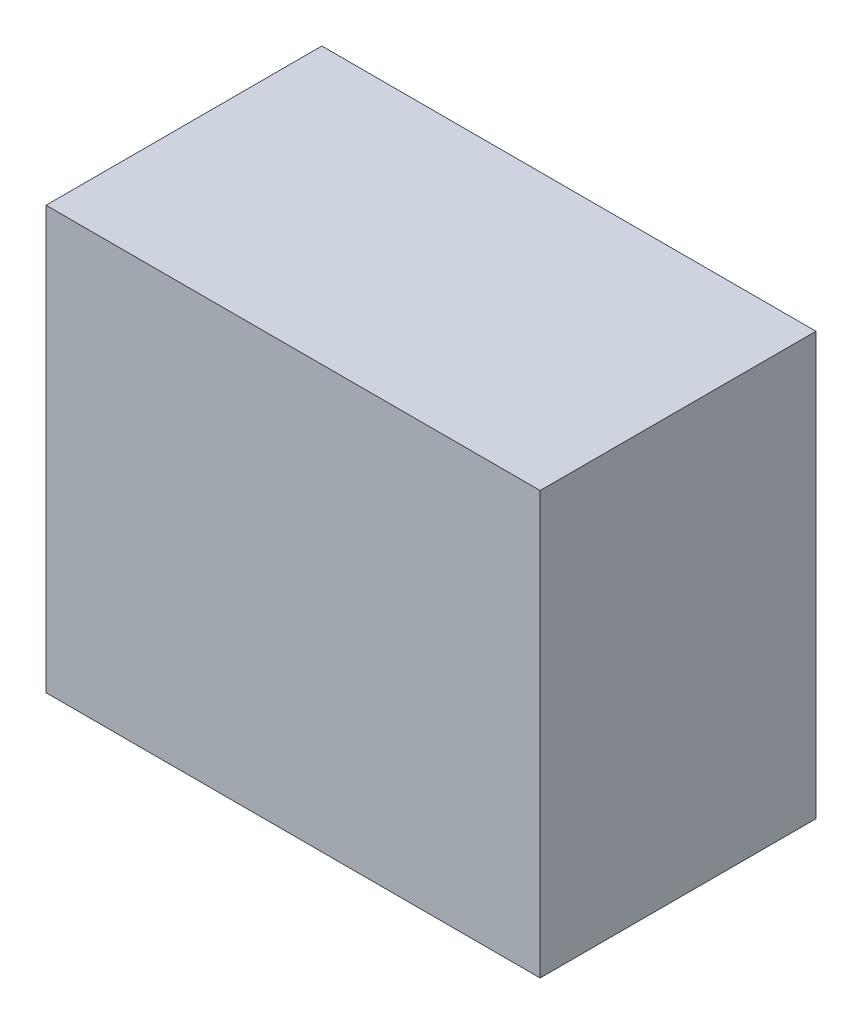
SolidWorks part; units mm, degrees
ref_plane "Plan de face" through (0, 0, 0) normal (0, 0, 1) x (1, 0, 0)
ref_plane "Plan de dessus" through (0, 0, 0) normal (0, 1, 0) x (1, 0, 0)
ref_plane "Plan de droite" through (0, 0, 0) normal (1, 0, 0) x (0, 0, -1)
sketch "Esquisse1" plane through (0, 0, 0) normal (0, 0, 1) x (1, 0, 0)
  line L1 (-90.1152, 67.3126) -> (178.6037, 67.3126)
  line L2 (-90.1152, 67.3126) -> (-90.1152, -162.292)
  line L3 (-90.1152, -162.292) -> (178.6037, -162.292)
  line L4 (178.6037, 67.3126) -> (178.6037, -162.292)
extrude "Extrusion1" add sketch "Esquisse1" along normal blind 150
